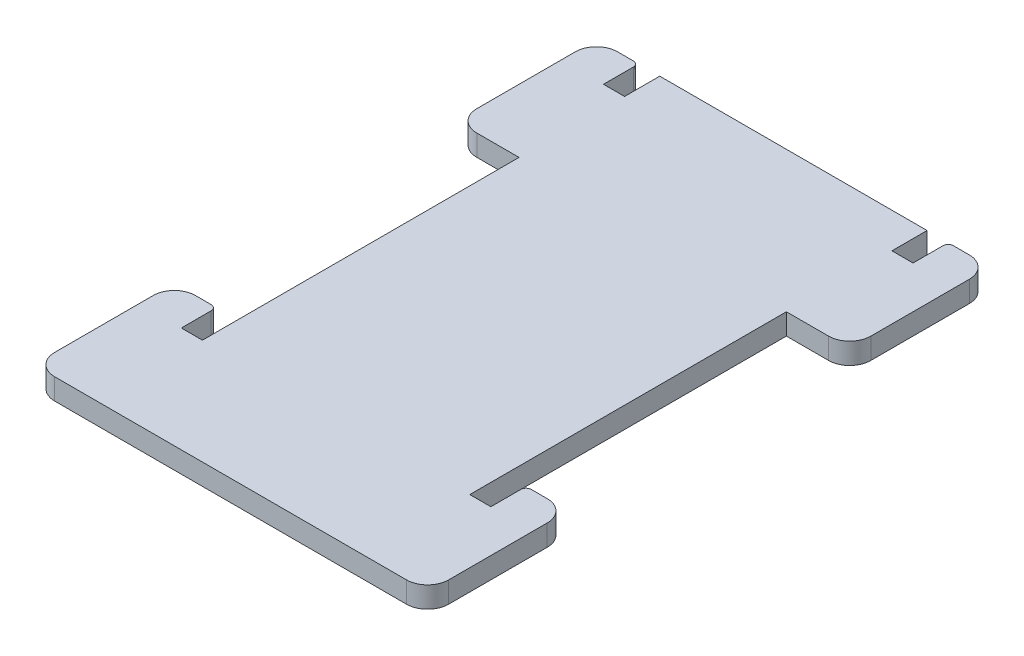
SolidWorks part; units mm, degrees
ref_plane "Front Plane" through (0, 0, 0) normal (0, 0, 1) x (1, 0, 0)
ref_plane "Top Plane" through (0, 0, 0) normal (0, 1, 0) x (1, 0, 0)
ref_plane "Right Plane" through (0, 0, 0) normal (1, 0, 0) x (0, 0, -1)
sketch "Sketch1" plane through (0, 0, 0) normal (0, 1, 0) x (1, 0, 0)
  line L0 (-55, 0) -> (55, 0) construction
  line L1 (0, 0) -> (38, 0)
  line L2 (0, 15) -> (0, 60)
  line L3 (0, 80) -> (38, 80)
  line L4 (38, 15) -> (38, 60)
  line L5 (38, 15) -> (41, 15)
  line L7 (38, 0) -> (41, 0)
  line L9 (38, 75) -> (38, 80)
  line L14 (38, 60) -> (41, 60)
  line L16 (38, 75) -> (41, 75)
  line L18 (41, 60) -> (47, 60)
  line L19 (41, 75) -> (41, 80)
  line L20 (41, 80) -> (47, 80)
  line L21 (47, 60) -> (47, 80)
  line L22 (41, 0) -> (47, 0)
  line L23 (41, 15) -> (41, 20)
  line L24 (41, 20) -> (47, 20)
  line L25 (47, 0) -> (47, 20)
  line L26 (19, 80) -> (19, 0) construction
  line L27 (0, 0) -> (-3, 0)
  line L28 (-3, 0) -> (-9, 0)
  line L29 (-9, 0) -> (-9, 20)
  line L30 (-3, 20) -> (-9, 20)
  line L31 (-3, 15) -> (-3, 20)
  line L32 (0, 15) -> (-3, 15)
  line L33 (0, 60) -> (-3, 60)
  line L34 (-3, 60) -> (-9, 60)
  line L35 (-9, 60) -> (-9, 80)
  line L36 (-3, 80) -> (-9, 80)
  line L37 (-3, 75) -> (-3, 80)
  line L38 (0, 75) -> (-3, 75)
  line L39 (0, 75) -> (0, 80)
  dimension "D1" = 38
  dimension "D2" = 80
  dimension "D3" = 3
  dimension "D4" = 6
  dimension "D5" = 3
  dimension "D6" = 6
  dimension "D7" = 20
  dimension "D8" = 15
  dimension "D9" = 15
  dimension "D10" = 20
  dimension "D11" = 40
extrude "Boss-Extrude1" add sketch "Sketch1" along normal blind 3
fillet "Fillet1" radius 3 4 edges at (47, 1.5, -20) (47, 1.5, -80) (-9, 1.5, -80) (-9, 1.5, -20)
fillet "Fillet2" radius 0.75 4 edges at (-3, 1.5, -80) (-3, 1.5, -20) (41, 1.5, -80) (41, 1.5, -20)
fillet "Fillet3" radius 3 4 edges at (-9, 1.5, -60) (-9, 1.5, 0) (47, 1.5, 0) (47, 1.5, -60)
